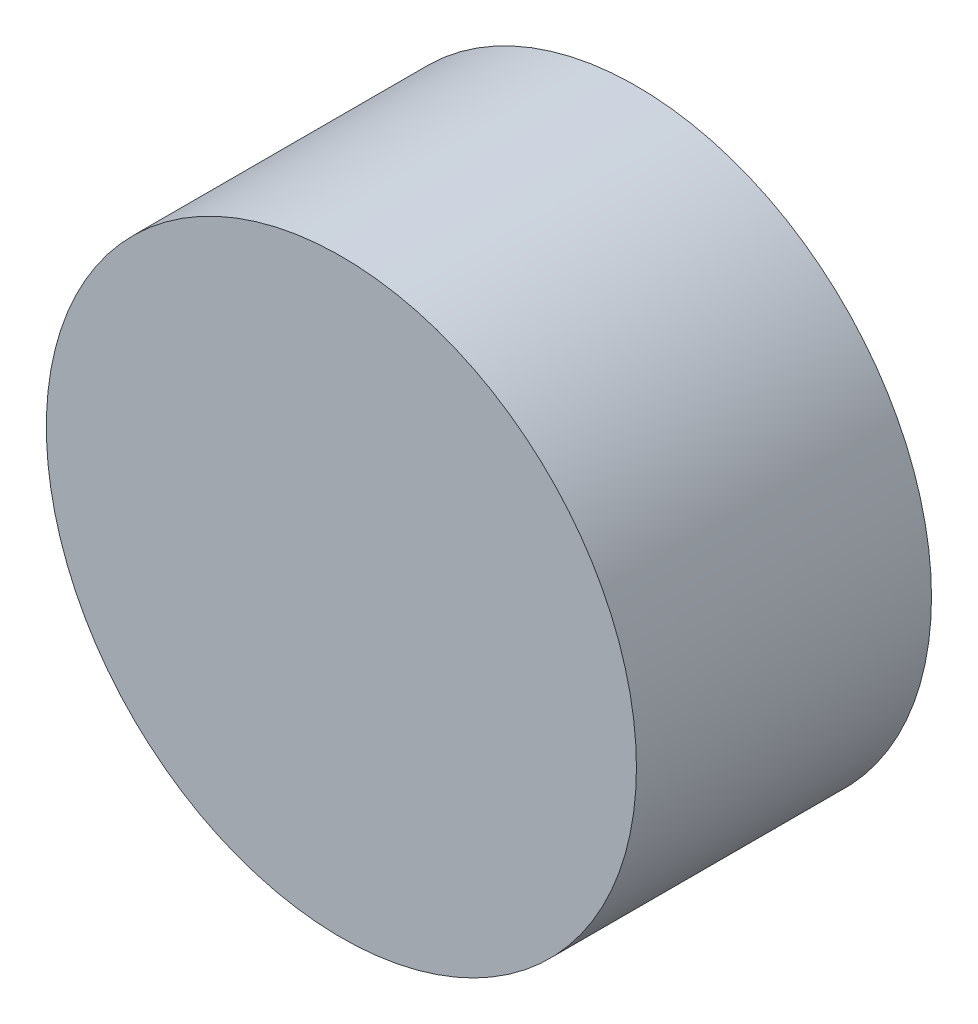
SolidWorks part; units mm, degrees
ref_plane "Přední rovina" through (0, 0, 0) normal (0, 0, 1) x (1, 0, 0)
ref_plane "Horní rovina" through (0, 0, 0) normal (0, 1, 0) x (1, 0, 0)
ref_plane "Pravá rovina" through (0, 0, 0) normal (1, 0, 0) x (0, 0, -1)
sketch "Skica1" plane through (0, 0, 0) normal (0, 0, 1) x (1, 0, 0)
  circle A0 centre (0, 0) radius 2
  dimension "D1" = 4
extrude "Přidat vysunutím1" add sketch "Skica1" along normal blind 2
